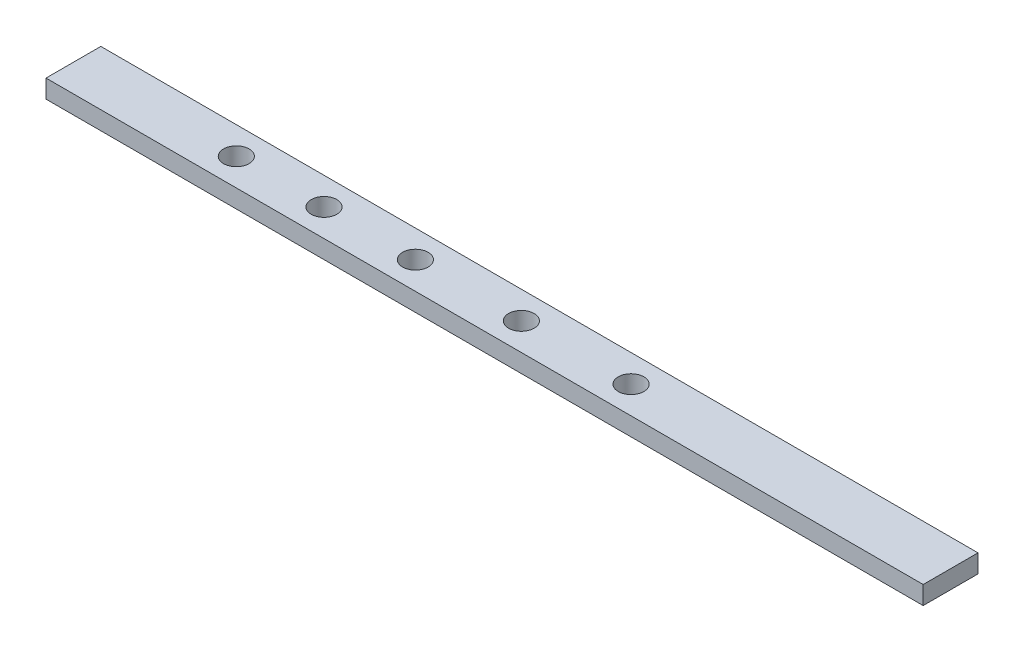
SolidWorks part; units mm, degrees
ref_plane "Front Plane" through (0, 0, 0) normal (0, 0, 1) x (1, 0, 0)
ref_plane "Top Plane" through (0, 0, 0) normal (0, 1, 0) x (1, 0, 0)
ref_plane "Right Plane" through (0, 0, 0) normal (1, 0, 0) x (0, 0, -1)
sketch "Sketch1" plane through (0, 0, 0) normal (0, 1, 0) x (1, 0, 0)
  line L1 (-104.1967, 25.9183) -> (200.6033, 25.9183)
  line L2 (-104.1967, 25.9183) -> (-104.1967, 6.8683)
  line L3 (-104.1967, 6.8683) -> (200.6033, 6.8683)
  line L4 (200.6033, 25.9183) -> (200.6033, 6.8683)
  line L5 (-104.1967, 25.9183) -> (200.6033, 6.8683) construction
  line L6 (-104.1967, 6.8683) -> (200.6033, 25.9183) construction
  point P0 (48.2033, 16.3933)
  dimension "D1" = 304.8
  dimension "D2" = 19.05
extrude "Boss-Extrude1" add sketch "Sketch1" along normal blind 6.35
sketch "Sketch2" plane through (0, 0, 0) normal (0, -1, 0) x (1, 0, 0)
  line L0 (-104.1967, -25.9183) -> (-104.1967, -6.8683) construction
  circle A0 centre (-47.5982, -16.3933) radius 4.445
  circle A1 centre (-17.1182, -16.3933) radius 4.445
  circle A2 centre (14.6318, -16.3933) radius 4.445
  circle A3 centre (51.4618, -16.3933) radius 4.445
  circle A4 centre (89.5618, -16.3933) radius 4.445
  point P15 (50.1006, -11.8179)
  dimension "D3" = 8.89
  dimension "D1" = 56.5985
  dimension "D2" = 31.75
  dimension "D4" = 30.48
  dimension "D5" = 36.83
  dimension "D6" = 38.1
extrude "Cut-Extrude1" cut sketch "Sketch2" against normal through all
